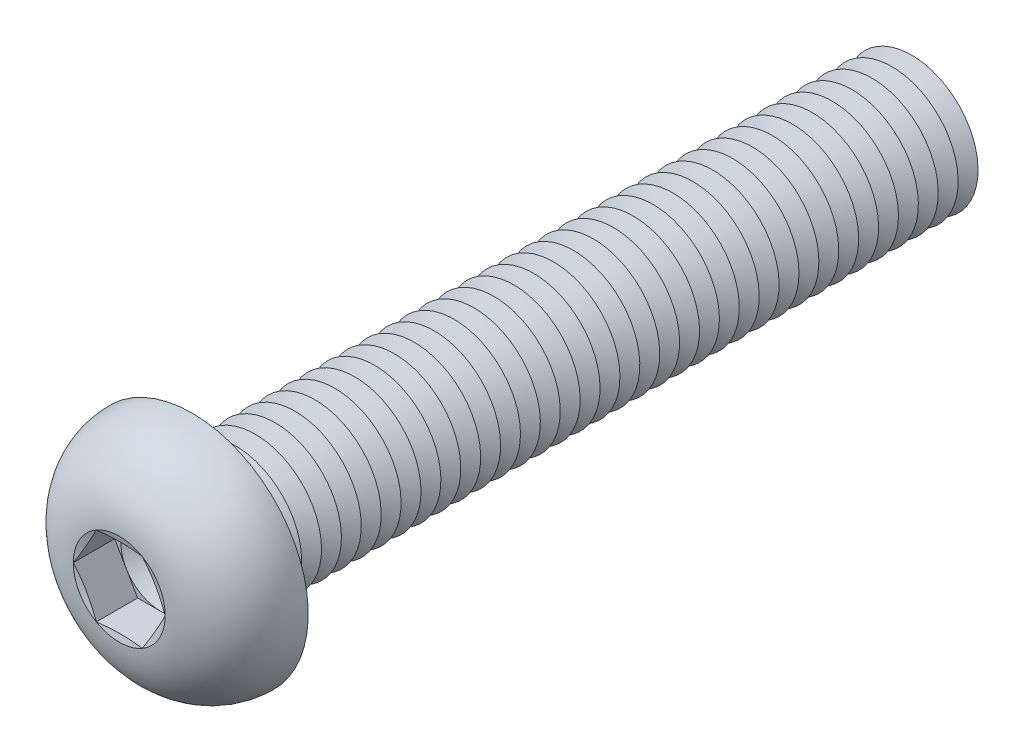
SolidWorks part; units mm, degrees
ref_plane "Front Plane" through (0, 0, 0) normal (0, 0, 1) x (1, 0, 0)
ref_plane "Top Plane" through (0, 0, 0) normal (0, 1, 0) x (1, 0, 0)
ref_plane "Right Plane" through (0, 0, 0) normal (1, 0, 0) x (0, 0, -1)
sketch "Sketch1" plane through (0, 0, 0) normal (1, 0, 0) x (0, 0, -1)
  line L0 (0, 5) -> (0, 8.75)
  line L3 (0, 5) -> (55, 5)
  line L4 (55, 5) -> (55, 0)
  line L5 (55, 0) -> (-5.5, 0) construction
  line L6 (-5.5, 0) -> (55, 0)
  line L7 (-5.5, 3.4641) -> (-5.5, 1.732) construction
  line L8 (-5.5, 1.732) -> (-5.5, 0)
  line L9 (-5.5, 3.4641) -> (-5.0359, 1.732)
  line L10 (-5.0359, 1.732) -> (-5.5, 1.732)
  line L11 (55, 0) -> (22.7481, 0) construction
  line L12 (0, 8.75) -> (-5.5, 8.75) construction
  arc A1 (0, 8.75) -> (-5.5, 3.4641) centre (0, 3.2457) ccw
  point P8 (55, 2.5)
  dimension "D1" = 17.5
  dimension "D2" = 10
  dimension "D3" = 5.5
  dimension "D4" = 6.9282
  dimension "D5" = 55
  dimension "D6" = 15
revolve "Revolve1" add sketch "Sketch1" angle 360 about L5
fillet "Fillet1" radius 0.75 1 edges at (0, 5, 0)
sketch "Sketch2" plane through (0, 0, 0) normal (1, 0, 0) x (0, 0, -1)
  line L0 (54.25, 5) -> (55.75, 5)
  line L1 (55, 5) -> (0.75, 5) construction
  line L2 (55.75, 5) -> (55, 3.701)
  line L3 (55, -5) -> (55, 5) construction
  line L4 (55, 3.701) -> (54.25, 5)
  dimension "D1" = 1.5
revolve "Cut-Revolve1" cut sketch "Sketch2" angle 360 about axis through (0, 0, -55) along (0, 0, -1)
pattern_linear "LPattern1" count 36 spacing 1.5 along (0, 0, 1) of "Cut-Revolve1"
sketch "Sketch3" plane through (0, 0, 5.5) normal (0, 0, 1) x (1, 0, 0)
  line L7 (1.732, 3) -> (-1.7321, 3)
  line L8 (-1.7321, 3) -> (-3.4641, 0)
  line L9 (-3.4641, 0) -> (-1.732, -3)
  line L10 (-1.732, -3) -> (1.732, -3)
  line L11 (1.732, -3) -> (3.4641, 0)
  line L12 (3.4641, 0) -> (1.732, 3)
  circle A0 centre (0, 0) radius 3 construction
  circle A3 centre (0, 0) radius 3.4641 construction
extrude "Cut-Extrude1" cut sketch "Sketch3" against normal blind 3.12
sketch "Sketch4" plane through (0, 0, 2.38) normal (0, 0, 1) x (1, 0, 0)
  line L1 (1.732, 3) -> (-1.7321, 3) construction
  circle A0 centre (0, 0) radius 3
extrude "Cut-Extrude2" cut sketch "Sketch4" against normal through all draft 60
